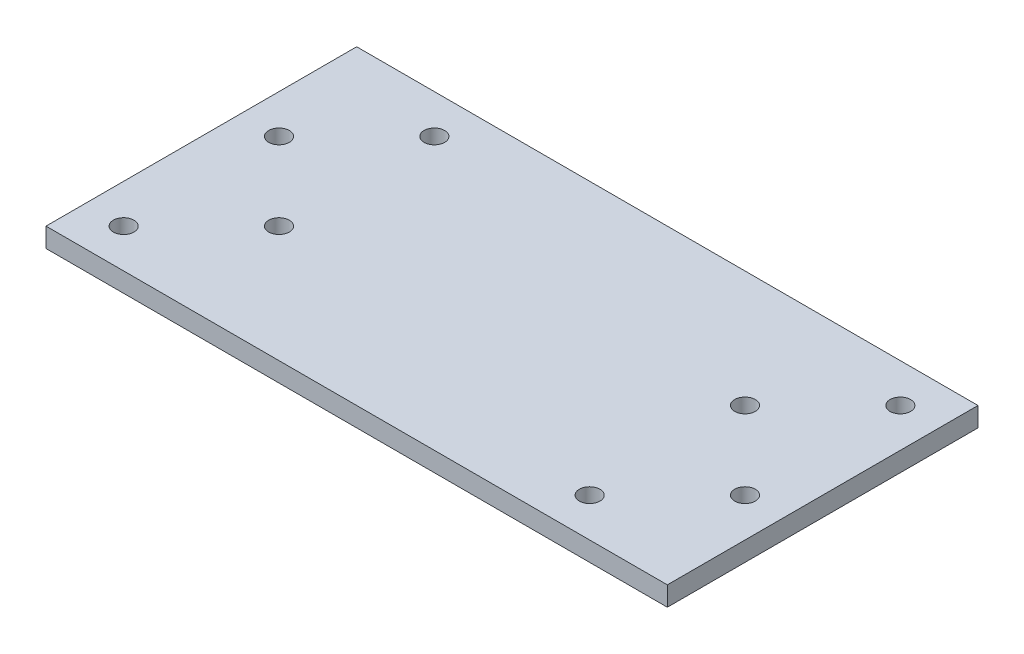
SolidWorks part; units mm, degrees
ref_plane "Front" through (0, 0, 0) normal (0, 0, 1) x (1, 0, 0)
ref_plane "Top" through (0, 0, 0) normal (0, 1, 0) x (1, 0, 0)
ref_plane "Right" through (0, 0, 0) normal (1, 0, 0) x (0, 0, -1)
sketch "Sketch1" plane through (0, 0, 0) normal (0, 1, 0) x (1, 0, 0)
  line L0 (0, 25.4) -> (203.2, 25.4) construction
  line L1 (0, 0) -> (203.2, 0)
  line L2 (0, 0) -> (0, 50.8)
  line L4 (203.2, 0) -> (203.2, 50.8)
  line L5 (38.1, 38.1) -> (118.3211, 38.1) construction
  line L6 (12.7, 12.7) -> (105.7547, 12.7) construction
  line L7 (190.5, 38.1) -> (38.1, 38.1) construction
  line L8 (114.3, 38.1) -> (114.3, 48.4539) construction
  line L9 (165.1, 12.7) -> (12.7, 12.7) construction
  line L10 (88.9, 12.7) -> (88.9, 3.7759) construction
  line L11 (203.2, 50.8) -> (161.4917, 50.8) construction
  line L13 (203.2, 50.8) -> (203.2, 101.6)
  line L14 (203.2, 101.6) -> (0, 101.6)
  line L15 (0, 50.8) -> (0, 101.6)
  line L16 (38.1, 88.9) -> (118.3211, 88.9) construction
  line L17 (12.7, 63.5) -> (105.7547, 63.5) construction
  line L18 (139.7, 88.9) -> (38.1, 88.9) construction
  line L19 (114.3, 63.5) -> (12.7, 63.5) construction
  circle A0 centre (12.7, 12.7) radius 3.3731
  circle A1 centre (38.1, 38.1) radius 3.3731
  circle A2 centre (190.5, 38.1) radius 3.3731
  circle A3 centre (165.1, 12.7) radius 3.3731
  circle A6 centre (12.7, 63.5) radius 3.3731
  circle A7 centre (38.1, 88.9) radius 3.3731
  circle A12 centre (190.5, 88.9) radius 3.3731
  circle A13 centre (165.1, 63.5) radius 3.3731
  dimension "D3" = 6.7462
  dimension "D8" = 12.7
  dimension "D9" = 25.4
  dimension "D10" = 12.7
  dimension "D1" = 50.8
  dimension "D2" = 203.2
  dimension "D4" = 12.7
  dimension "D5" = 12.7
  dimension "D6" = 12.7
  dimension "D7" = 38.1
  dimension "D12" = 101.6
extrude "Extrude1" add sketch "Sketch1" along normal blind 6.35
